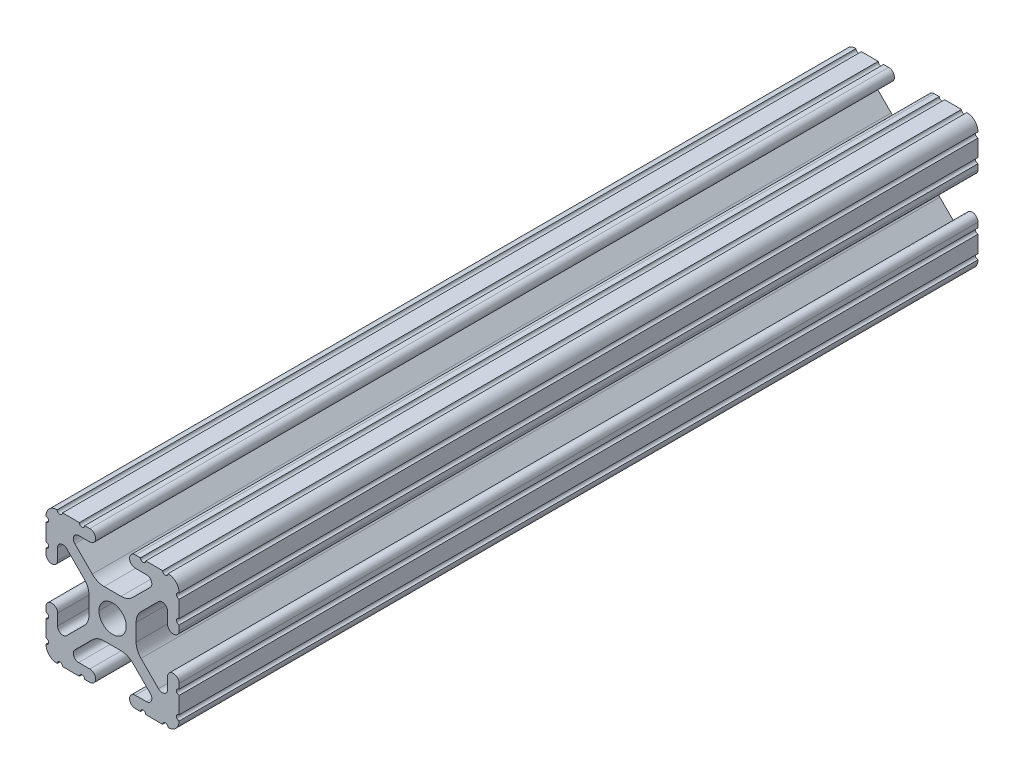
SolidWorks part; units mm, degrees
ref_plane "Front Plane" through (0, 0, 0) normal (0, 0, 1) x (1, 0, 0)
ref_plane "Top Plane" through (0, 0, 0) normal (0, 1, 0) x (1, 0, 0)
ref_plane "Right Plane" through (0, 0, 0) normal (1, 0, 0) x (0, 0, -1)
imported_body "1010_12_CL.sldprt"
sketch "Sketch1" plane through (0, 0, 0) normal (0, 0, 1) x (1, 0, 0)
  line L1 (-40.2791, 38.2821) -> (38.1267, 38.2821)
  line L2 (-40.2791, 38.2821) -> (-40.2791, -52.7101)
  line L3 (-40.2791, -52.7101) -> (38.1267, -52.7101)
  line L4 (38.1267, 38.2821) -> (38.1267, -52.7101)
extrude "Cut-Extrude1" cut sketch "Sketch1" against normal blind 152.4
